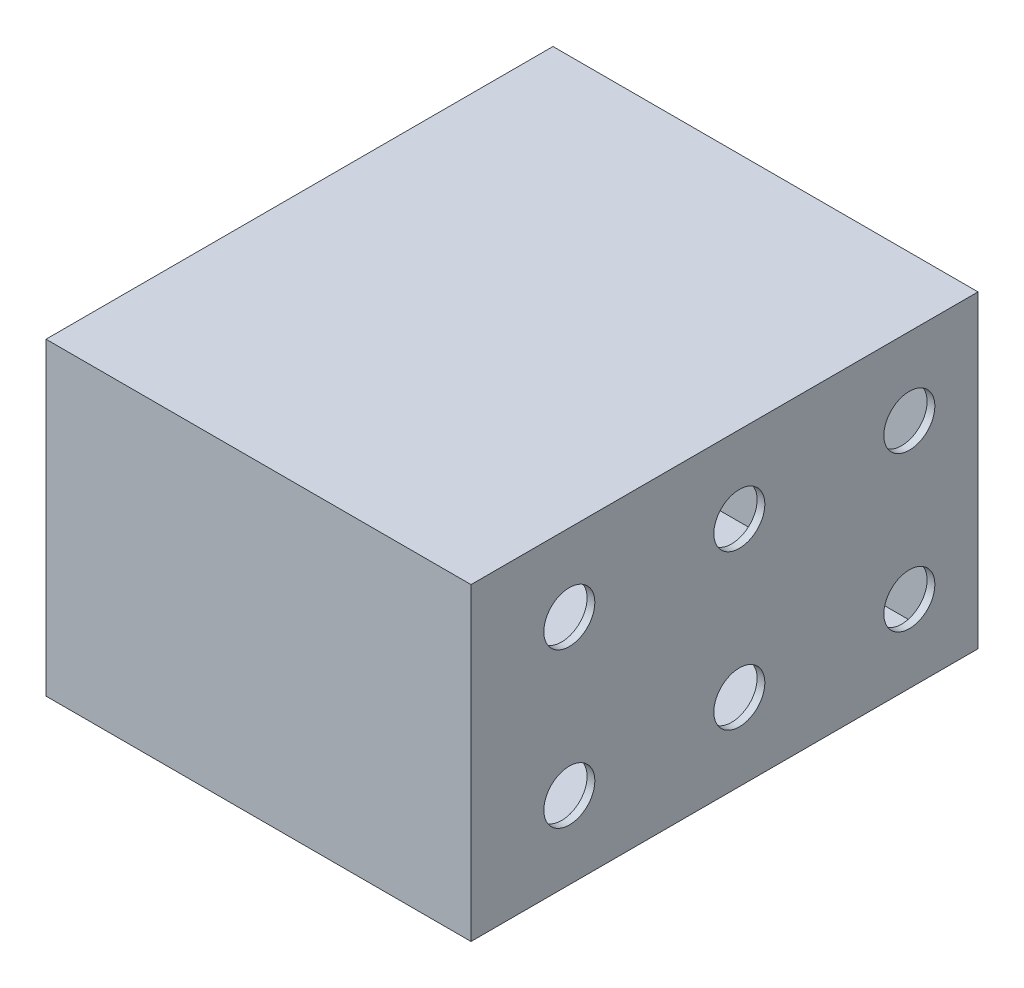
SolidWorks part; units mm, degrees
ref_plane "Alzado" through (0, 0, 0) normal (1, 0, 0) x (0, 1, 0)
ref_plane "Planta" through (0, 0, 0) normal (0, 0, 1) x (0, 1, 0)
ref_plane "Vista lateral" through (0, 0, 0) normal (0, 1, 0) x (-1, 0, 0)
sketch "Croquis5" plane through (0, 0, 0) normal (1, 0, 0) x (0, 1, 0)
  line L0 (0, 0) -> (0, 2.8026)
  line L2 (0, 0) -> (0, -30)
  line L3 (0, -30) -> (20, -30)
  line L4 (20, 0) -> (20, -30)
  line L5 (0, 2.8026) -> (20, 2.8026)
  line L6 (20, 2.8026) -> (20, 0)
  dimension "D1" = 20
  dimension "D2" = 30
extrude "Saliente-Extruir4" add sketch "Croquis5" along normal blind 27.5
sketch "Croquis6" plane through (0, 0, 0) normal (-1, 0, 0) x (0, -1, 0)
  line L1 (-19.6395, -29.0332) -> (-0.3605, -29.0332)
  line L2 (-19.6395, -29.0332) -> (-19.6395, 1.9906)
  line L3 (-19.6395, 1.9906) -> (-0.3605, 1.9906)
  line L4 (-0.3605, -29.0332) -> (-0.3605, 1.9906)
  line L5 (-19.6395, -29.0332) -> (-0.3605, 1.9906) construction
  line L6 (-19.6395, 1.9906) -> (-0.3605, -29.0332) construction
  point P0 (-10, -13.5213)
extrude "Cortar-Extruir1" cut sketch "Croquis6" against normal blind 27
sketch "Croquis8" plane through (27.5, 0, 0) normal (1, 0, 0) x (0, 1, 0)
  line L0 (0, 2.8026) -> (0, -30) construction
  line L1 (20, -30) -> (20, 2.8026) construction
  circle A0 centre (5, -3.5584) radius 1.65
  circle A1 centre (15, -3.5584) radius 1.65
  dimension "D1" = 3.3
  dimension "D3" = 5
  dimension "D2" = 5
extrude "Cortar-Extruir3" cut sketch "Croquis8" against normal blind 1
pattern_linear "MatrizL1" count 3 spacing 11 along (0, 0, -1) of "Cortar-Extruir3"
